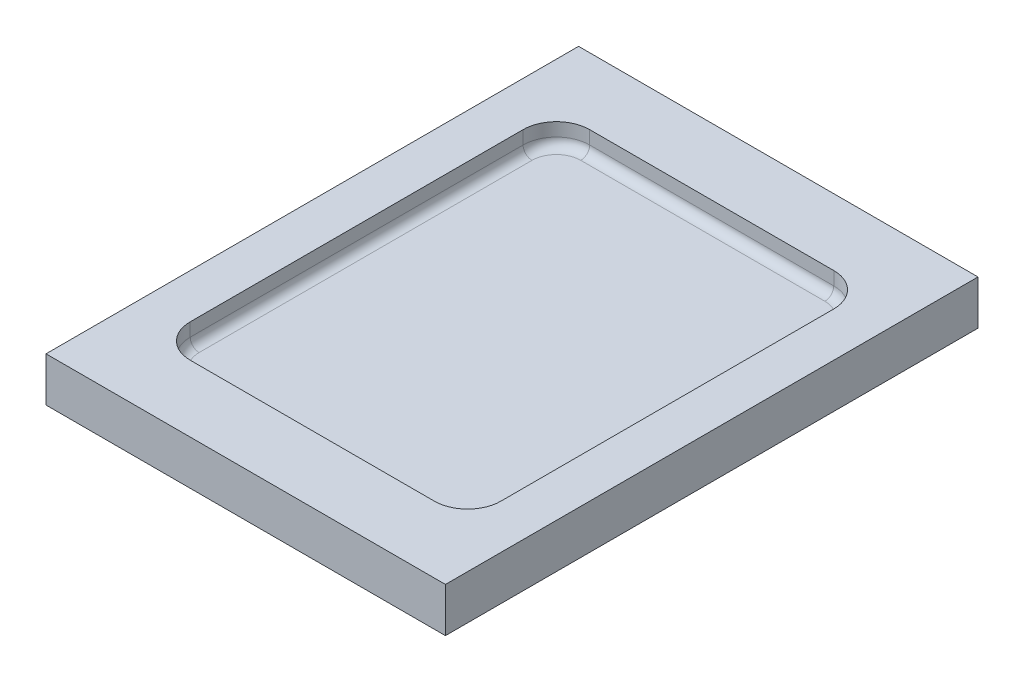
SolidWorks part; units mm, degrees
ref_plane "Front Plane" through (0, 0, 0) normal (0, 0, 1) x (1, 0, 0)
ref_plane "Top Plane" through (0, 0, 0) normal (0, 1, 0) x (1, 0, 0)
ref_plane "Right Plane" through (0, 0, 0) normal (1, 0, 0) x (0, 0, -1)
sketch "Sketch1" plane through (0, 0, 0) normal (0, 1, 0) x (1, 0, 0)
  line L0 (-57.15, -76.2) -> (57.15, 76.2) construction
  line L1 (-57.15, 76.2) -> (57.15, 76.2)
  line L2 (-57.15, 76.2) -> (-57.15, -76.2)
  line L3 (-57.15, -76.2) -> (57.15, -76.2)
  line L4 (57.15, 76.2) -> (57.15, -76.2)
  dimension "D1" = 114.3
  dimension "D2" = 152.4
extrude "Extrude1" add sketch "Sketch1" along normal blind 12.7
sketch "Sketch3" plane through (0, 12.7, 0) normal (0, 1, 0) x (-1, 0, 0)
  line L0 (44.45, -57.15) -> (-44.45, 57.15) construction
  line L1 (-44.45, -57.15) -> (44.45, -57.15)
  line L2 (-44.45, -57.15) -> (-44.45, 57.15)
  line L3 (-44.45, 57.15) -> (44.45, 57.15)
  line L4 (44.45, -57.15) -> (44.45, 57.15)
  dimension "D1" = 114.3
  dimension "D2" = 88.9
extrude "Cut-Extrude1" cut sketch "Sketch3" against normal blind 6.35
fillet "Fillet1" radius 2.54 4 edges at (44.45, 6.35, 0) (0, 6.35, 57.15) (-44.45, 6.35, 0) (0, 6.35, -57.15)
fillet "Fillet2" radius 9.525 8 edges at (-44.45, 10.795, 57.15) (-44.45, 10.795, -57.15) (44.45, 10.795, 57.15) (44.45, 10.795, -57.15) (43.7061, 7.0939, -56.4061) (43.7061, 7.0939, 56.4061) (-43.7061, 7.0939, -56.4061) (-43.7061, 7.0939, 56.4061)
